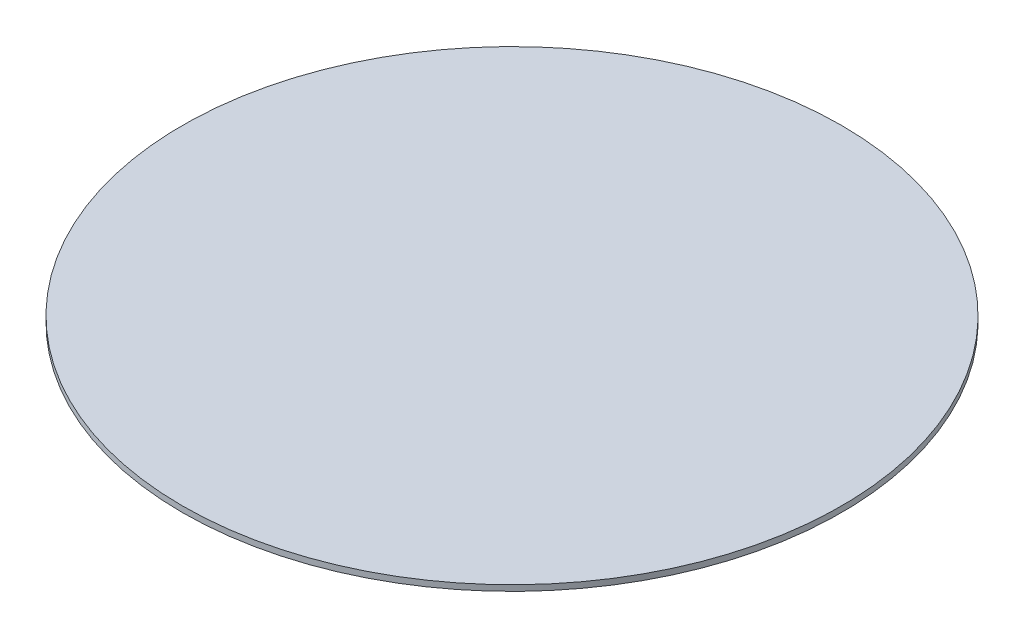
SolidWorks part; units mm, degrees
ref_plane "Front Plane" through (0, 0, 0) normal (0, 0, 1) x (1, 0, 0)
ref_plane "Top Plane" through (0, 0, 0) normal (0, 1, 0) x (1, 0, 0)
ref_plane "Right Plane" through (0, 0, 0) normal (1, 0, 0) x (0, 0, -1)
sketch "Sketch1" plane through (0, 0, 0) normal (0, 1, 0) x (1, 0, 0)
  circle A0 centre (0, 0) radius 62.5
  dimension "D1" = 125
extrude "Boss-Extrude1" add sketch "Sketch1" along normal blind 1.1
